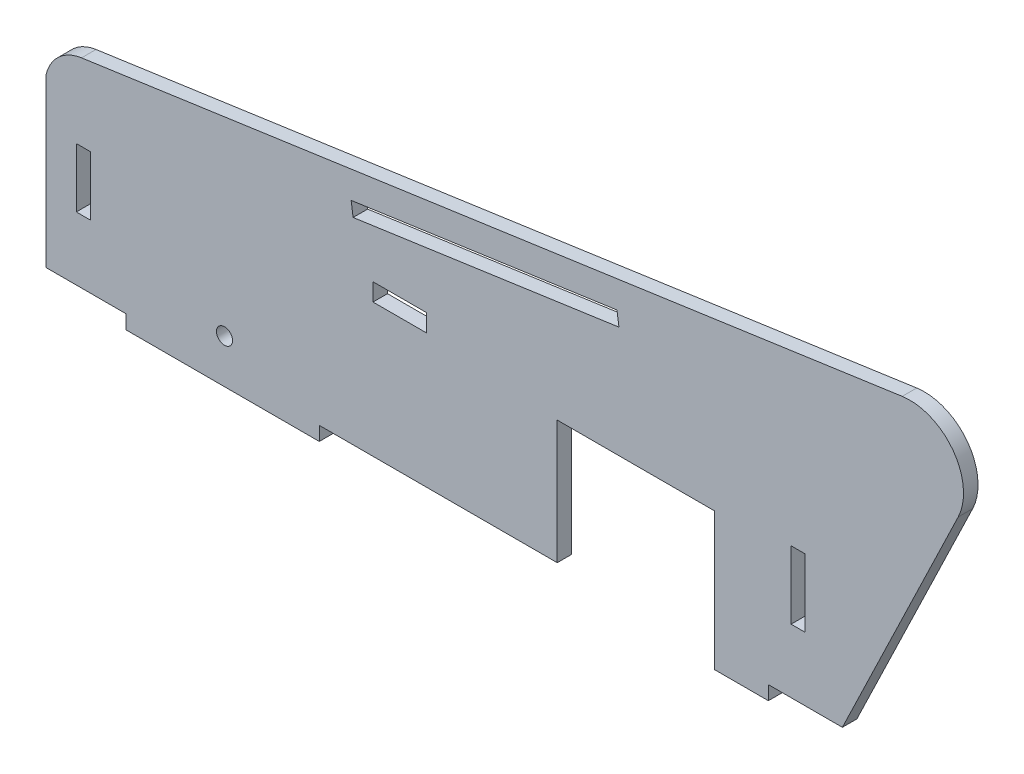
SolidWorks part; units mm, degrees
ref_plane "Alzado" through (0, 0, 0) normal (0, 0, 1) x (1, 0, 0)
ref_plane "Planta" through (0, 0, 0) normal (0, 1, 0) x (1, 0, 0)
ref_plane "Vista lateral" through (0, 0, 0) normal (1, 0, 0) x (0, 0, -1)
sketch "Croquis1" plane through (0, 0, 0) normal (0, 0, 1) x (1, 0, 0)
  line L3 (-35.2812, -24.8828) -> (-20.3937, -24.8828)
  line L9 (59.9113, -1.8828) -> (89.2163, -1.8828)
  line L14 (25.6063, 3.2701) -> (35.6063, 3.2701)
  line L15 (25.6063, 3.2701) -> (25.6063, 0)
  line L16 (25.6063, 0) -> (35.6063, 0)
  line L17 (35.6063, 3.2701) -> (35.6063, 0)
  line L20 (15.6063, -24.8828) -> (20.2163, -24.8828)
  line L28 (-20.3937, -24.8828) -> (-20.3937, -27.4828)
  line L29 (-20.3937, -27.4828) -> (15.6063, -27.4828)
  line L30 (15.6063, -24.8828) -> (15.6063, -27.4828)
  line L74 (89.2163, -27.4828) -> (99.2228, -27.4828)
  line L84 (99.2228, -27.4828) -> (99.2228, -24.8828)
  line L85 (99.2228, -24.8828) -> (113.0012, -24.8828)
  line L91 (-35.2812, 6.2076) -> (-35.2812, -24.8828)
  line L93 (124.1469, 34.0611) -> (-28.6699, 12.2396)
  line L94 (134.5671, 19.8161) -> (113.0012, -24.8828)
  line L95 (-27.0387, -2.0602) -> (-29.6387, -2.0602)
  line L96 (-27.0387, -2.0602) -> (-27.0387, -13.0984)
  line L97 (-27.0387, -13.0984) -> (-29.6387, -13.0984)
  line L98 (-29.6387, -2.0602) -> (-29.6387, -13.0984)
  line L99 (20.2163, -24.8828) -> (59.9113, -24.8828)
  line L101 (71.0327, 21.4259) -> (21.5348, 14.3579)
  line L102 (106.0539, -0.3828) -> (103.4539, -0.3828)
  line L103 (106.0539, -0.3828) -> (106.0539, -13.0234)
  line L104 (106.0539, -13.0234) -> (103.4539, -13.0234)
  line L105 (103.4539, -0.3828) -> (103.4539, -13.0234)
  line L106 (71.4002, 18.852) -> (21.9023, 11.784)
  line L107 (59.9113, -24.8828) -> (59.9113, -6.8828)
  line L108 (21.5348, 14.3579) -> (21.9023, 11.784)
  line L109 (71.0327, 21.4259) -> (71.4002, 18.852)
  line L110 (124.8537, 29.1113) -> (-27.9631, 7.2898) construction
  line L111 (125.2213, 26.5374) -> (-27.5956, 4.7159) construction
  line L112 (89.2163, -6.8828) -> (89.2163, -27.4828)
  line L113 (89.2163, -6.8828) -> (89.2163, -1.8828)
  line L114 (59.9113, -6.8828) -> (59.9113, -1.8828)
  circle A12 centre (-2.0428, -19.3011) radius 1.5
  arc A14 (-28.6699, 12.2396) -> (-35.2812, 6.2076) centre (-27.546, 4.3687) ccw
  arc A15 (124.1469, 34.0611) -> (134.5671, 19.8161) centre (125.5605, 24.1615) cw
  point P19 (110.9268, -3.0476)
  point P21 (90.5866, 38.4588)
  point P33 (0.9572, -19.3011)
  point P34 (-2.0428, -1.8011)
  point P37 (0.9572, -1.8011)
  point P41 (15.4572, -16.3011)
  point P42 (-19.5428, -16.3011)
  point P48 (-5.0428, -16.3011)
  dimension "D2" = 10
  dimension "D4" = 3
  dimension "D1" = 0
  dimension "D5" = 5
  dimension "D6" = 2.6
  dimension "D8" = 50
extrude "Saliente-Extruir1" add sketch "Croquis1" along normal blind 2.7
